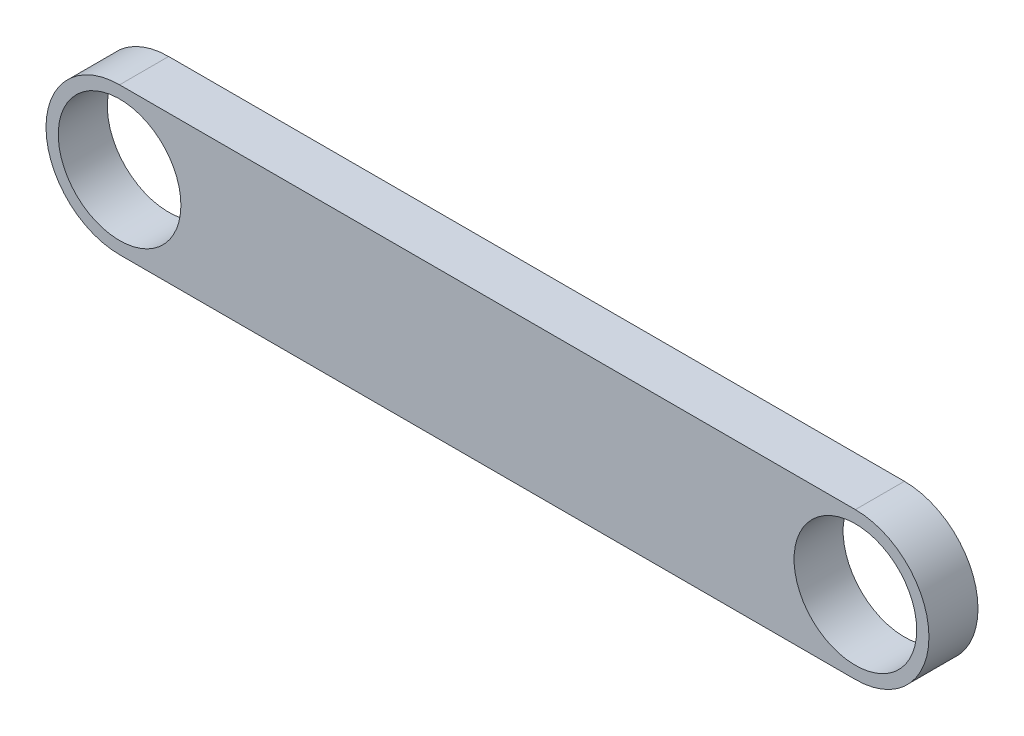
SolidWorks part; units mm, degrees
ref_plane "Front Plane" through (0, 0, 0) normal (0, 0, 1) x (1, 0, 0)
ref_plane "Top Plane" through (0, 0, 0) normal (0, 1, 0) x (1, 0, 0)
ref_plane "Right Plane" through (0, 0, 0) normal (1, 0, 0) x (0, 0, -1)
sketch "Sketch1" plane through (0, 0, 0) normal (0, 0, 1) x (1, 0, 0)
  line L0 (0, 0) -> (150, 0) construction
  line L1 (0, 15) -> (150, 15)
  line L2 (0, -15) -> (150, -15)
  arc A0 (0, 15) -> (0, -15) centre (0, 0) ccw
  arc A1 (150, -15) -> (150, 15) centre (150, 0) ccw
  circle A2 centre (0, 0) radius 12.5
  circle A3 centre (150, 0) radius 12.5
  point P3 (75, 0)
  dimension "D1" = 15
  dimension "D2" = 150
  dimension "D3" = 25
  dimension "D4" = 25
extrude "Boss-Extrude1" add sketch "Sketch1" along normal blind 10
